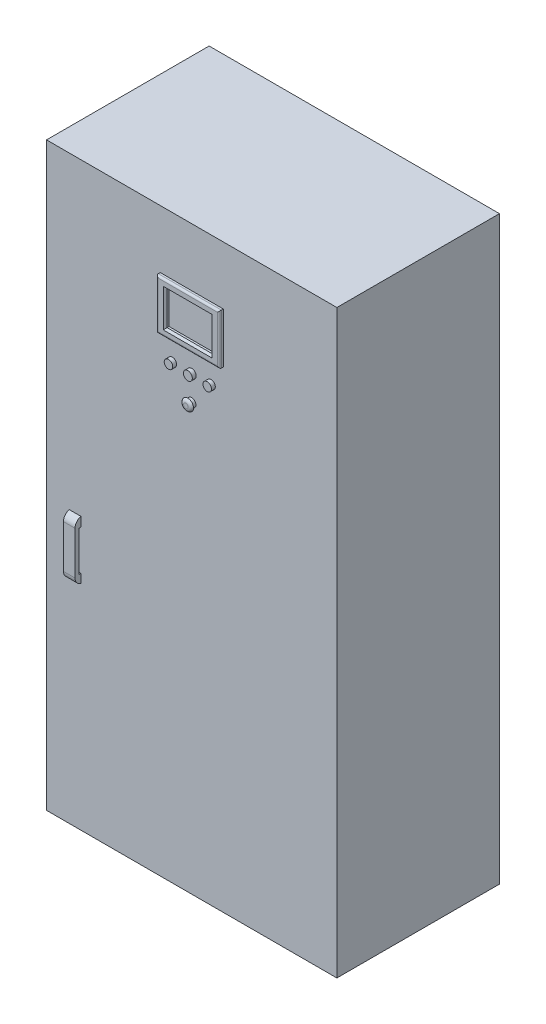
SolidWorks part; units mm, degrees
ref_plane "Plan de face" through (0, 0, 0) normal (0, 0, 1) x (1, 0, 0)
ref_plane "Plan de dessus" through (0, 0, 0) normal (0, 1, 0) x (1, 0, 0)
ref_plane "Plan de droite" through (0, 0, 0) normal (1, 0, 0) x (0, 0, -1)
sketch "Esquisse1" plane through (0, 0, 0) normal (0, 1, 0) x (1, 0, 0)
  line L1 (0, 0) -> (750, 0)
  line L2 (0, 0) -> (0, 420)
  line L3 (0, 420) -> (750, 420)
  line L4 (750, 0) -> (750, 420)
  dimension "D1" = 750
  dimension "D2" = 420
extrude "Extrusion1" add sketch "Esquisse1" along normal blind 1500
sketch "Esquisse2" plane through (0, 0, 0) normal (0, 0, 1) x (1, 0, 0)
  text T0 "ArmoireThalassa  " font "Century Gothic" height in points 72
sketch "Esquisse3" plane through (0, 0, 0) normal (0, 0, 1) x (1, 0, 0)
  line L0 (0, 1500) -> (0, 0) construction
  line L2 (316.5, 1240.6522) -> (432.0225, 1240.6522)
  line L3 (316.5, 1240.6522) -> (316.5, 1328.2852)
  line L4 (316.5, 1328.2852) -> (432.0225, 1328.2852)
  line L5 (293.5, 1350) -> (456.5, 1350)
  line L6 (293.5, 1350) -> (293.5, 1220)
  line L7 (293.5, 1220) -> (456.5, 1220)
  line L8 (456.5, 1350) -> (456.5, 1220)
  line L9 (432.0225, 1240.6522) -> (432.0225, 1328.2852)
  line L12 (0, 1500) -> (750, 1500) construction
  dimension "D1" = 130
  dimension "D2" = 163
  dimension "D3" = 145
  dimension "D4" = 23
  dimension "D5" = 293.5
  dimension "D6" = 150
extrude "Extrusion2" add sketch "Esquisse3" along normal blind 10
sketch "Esquisse4" plane through (0, 0, 0) normal (0, 0, 1) x (1, 0, 0)
  text T0 "SCHNEIDER" font "Century Gothic" height in points 48
sketch "Esquisse6" plane through (0, 0, 0) normal (0, 0, 1) x (1, 0, 0)
  line L0 (293.5, 1350) -> (293.5, 1220) construction
  line L1 (293.5, 1220) -> (456.5, 1220) construction
  circle A0 centre (325, 1165.4856) radius 11
  circle A1 centre (425, 1165.4856) radius 11
  circle A2 centre (375, 1100) radius 11
  dimension "D1" = 22
  dimension "D2" = 22
  dimension "D3" = 22
  dimension "D4" = 100
  dimension "D5" = 50
  dimension "D6" = 81.5
  dimension "D7" = 120
extrude "Extrusion3" add sketch "Esquisse6" along normal blind 10
sketch "Esquisse7" plane through (0, 0, 10) normal (0, 0, 1) x (1, 0, 0)
  circle A0 centre (375, 1100) radius 14.7067
extrude "Extrusion4" add sketch "Esquisse7" along normal blind 5
fillet "Congé2" radius 10 1 edges at (389.7067, 1100, 15)
fillet "Congé4" radius 5 4 edges at (456.5, 1285, 10) (375, 1220, 10) (293.5, 1285, 10) (375, 1350, 10)
sketch "Esquisse8" plane through (0, 0, 0) normal (0, 0, 1) x (1, 0, 0)
  line L1 (58.6658, 702.2144) -> (88.6658, 702.2144)
  line L2 (58.6658, 702.2144) -> (58.6658, 552.2144)
  line L3 (58.6658, 552.2144) -> (88.6658, 552.2144)
  line L4 (88.6658, 702.2144) -> (88.6658, 552.2144)
  dimension "D1" = 150
  dimension "D2" = 30
extrude "Extrusion5" add sketch "Esquisse8" along normal blind 15
chamfer "Chanfrein1" distance 5 angle 45 4 edges at (432.0225, 1284.4687, 10) (374.2613, 1240.6522, 10) (374.2613, 1328.2852, 10) (316.5, 1284.4687, 10)
fillet "Congé6" radius 20 2 edges at (73.6658, 552.2144, 15) (73.6658, 702.2144, 15)
sketch "Esquisse9" plane through (88.6658, 0, 0) normal (1, 0, 0) x (0, 0, -1)
  line L0 (0, 552.2144) -> (0, 702.2144) construction
  line L1 (0, 574.4976) -> (-4.8128, 574.4976)
  line L2 (0, 574.4976) -> (0, 677.9932)
  line L3 (0, 677.9932) -> (-4.8128, 677.9932)
  line L4 (-4.8128, 574.4976) -> (-4.8128, 677.9932)
extrude "Extrusion6" cut sketch "Esquisse9" against normal blind 10
sketch "Esquisse10" plane through (58.6658, 0, 0) normal (-1, 0, 0) x (0, 0, 1)
  line L0 (0, 702.2144) -> (0, 552.2144) construction
  line L1 (0, 573.9022) -> (4.628, 573.9022)
  line L2 (0, 573.9022) -> (0, 678.9406)
  line L3 (0, 678.9406) -> (4.628, 678.9406)
  line L4 (4.628, 573.9022) -> (4.628, 678.9406)
extrude "Extrusion7" cut sketch "Esquisse10" against normal blind 10
sketch "Esquisse11" plane through (0, 0, 0) normal (0, 0, 1) x (1, 0, 0)
  circle A0 centre (375, 1164.8998) radius 11.5
  circle A1 centre (325, 1165.4856) radius 11 construction
  dimension "D1" = 50
extrude "Extrusion8" add sketch "Esquisse11" along normal blind 10
hole_wizard "Dégagement M101" positions "Esquisse3D1" profile "Esquisse12" hole size "M10" standard "ISO"
sketch3d "Esquisse3D1"
  point P0 (125.8095, 0, -389.0046)
  point P2 (125.9289, 0, -45.4694)
  point P4 (622.5646, 0, -44.0988)
  point P6 (622.0369, 0, -389.4968)
sketch "Esquisse12" plane through (125.8095, 0, -389.0046) normal (1, 0, 0) x (0, 0, -1)
  line L0 (0, 0) -> (0, 13.3047)
  line L1 (0, 13.3047) -> (5.5, 10)
  line L2 (5.5, 10) -> (5.5, 0)
  line L5 (5.5, 0) -> (0, 0)
  line L10 (0, 13.3047) -> (-5.5, 10) construction
  line L11 (0, -6.35) -> (0, 107.95) construction
  dimension "Diamètre du perçage" = 11
  dimension "Profondeur du perçage" = 10
  dimension "Angle de pointe" = 118
